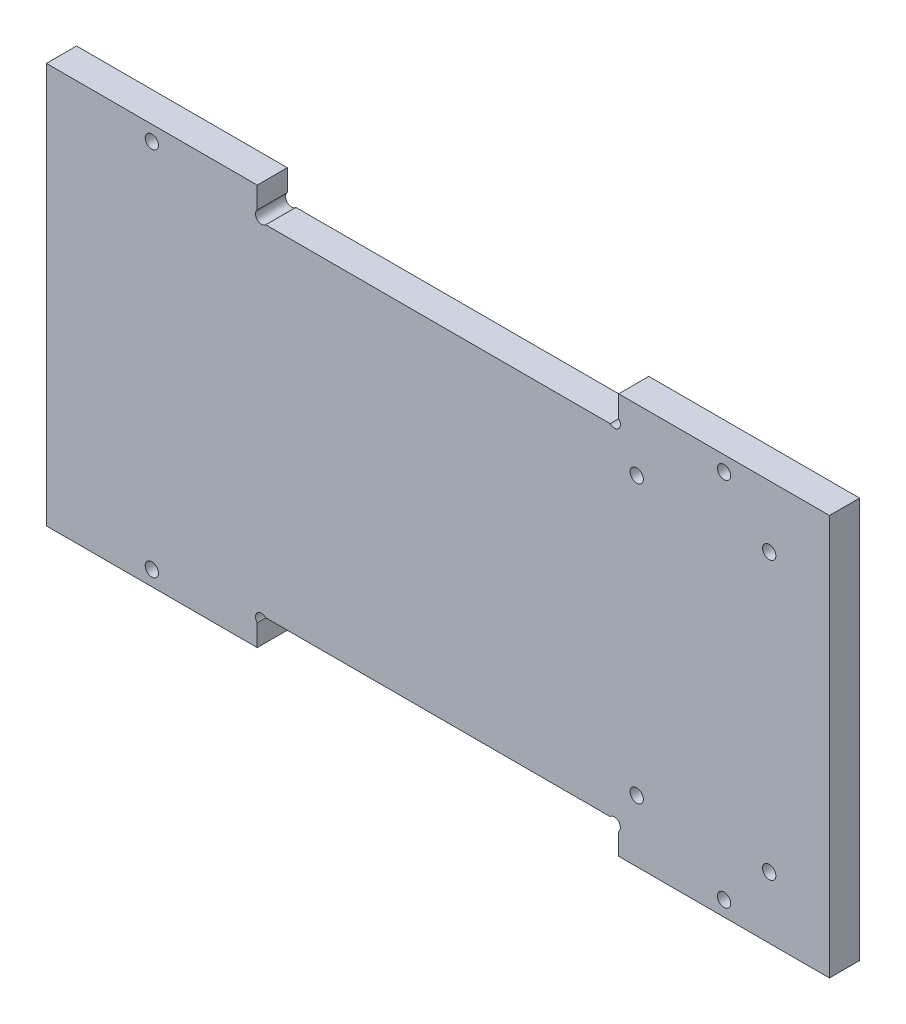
SolidWorks part; units mm, degrees
ref_plane "Plan de face" through (0, 0, 0) normal (0, 0, 1) x (1, 0, 0)
ref_plane "Plan de dessus" through (0, 0, 0) normal (0, 1, 0) x (1, 0, 0)
ref_plane "Plan de droite" through (0, 0, 0) normal (1, 0, 0) x (0, 0, -1)
sketch "Esquisse1" plane through (0, 0, 0) normal (0, 0, 1) x (1, 0, 0)
  line L1 (0, 0) -> (130, 0)
  line L2 (0, 0) -> (0, 66.5)
  line L3 (0, 66.5) -> (130, 66.5)
  line L4 (130, 0) -> (130, 66.5)
  dimension "D1" = 66.5
  dimension "D2" = 130
extrude "Boss.-Extru.1" add sketch "Esquisse1" along normal blind 5
sketch "Esquisse2" plane through (0, 0, 5) normal (0, 0, 1) x (1, 0, 0)
  line L0 (130, 66.5) -> (0, 66.5) construction
  line L1 (0, 66.5) -> (0, 0) construction
  line L3 (5.5, 51.25) -> (81, 51.25) construction
  line L4 (3.5, 15.25) -> (83, 15.25) construction
  circle A0 centre (81, 51.25) radius 1.1
  circle A1 centre (3.5, 15.25) radius 1.1
  circle A2 centre (83, 15.25) radius 1.1
  point P10 (5.5, 51.25)
  dimension "D1" = 2.2
  dimension "D4" = 36
  dimension "D5" = 79.5
  dimension "D6" = 2.2
  dimension "D7" = 2.2
  dimension "D2" = 15.25
  dimension "D3" = 75.5
  dimension "D8" = 81
  dimension "D9" = 3.5
extrude "Enlèv. mat.-Extru.1" [suppressed] cut sketch "Esquisse2" against normal up to next
sketch "Esquisse3" plane through (0, 0, 5) normal (0, 0, 1) x (1, 0, 0)
  line L0 (130, 66.5) -> (0, 66.5) construction
  line L2 (130, 0) -> (130, 66.5) construction
  circle A0 centre (120, 56.25) radius 1.1
  circle A1 centre (120, 10.25) radius 1.1
  circle A2 centre (98, 10.25) radius 1.1
  circle A3 centre (98, 56.25) radius 1.1
  dimension "D1" = 2.2
  dimension "D2" = 2.2
  dimension "D3" = 2.2
  dimension "D4" = 2.2
  dimension "D5" = 22
  dimension "D6" = 46
  dimension "D7" = 10.25
  dimension "D8" = 10
extrude "Enlèv. mat.-Extru.2" cut sketch "Esquisse3" against normal up to next
sketch "Esquisse4" [suppressed] plane through (0, 0, 0) normal (0, 0, -1) x (-1, 0, 0)
  circle A0 centre (-3.5, 15.25) radius 2
  circle A1 centre (-81, 51.25) radius 2
  circle A2 centre (-83, 15.25) radius 2
  dimension "D1" = 4
  dimension "D2" = 4
  dimension "D3" = 4
extrude "Enlèv. mat.-Extru.3" [suppressed] cut sketch "Esquisse4" against normal blind 1.5
sketch "Esquisse6" plane through (0, 0, 0) normal (0, 0, -1) x (-1, 0, 0)
  line L0 (-65, 0) -> (-65, 66.5) construction
  line L1 (0, 0) -> (-130, 0) construction
  line L2 (-130, 66.5) -> (0, 66.5) construction
  line L4 (-35, 0) -> (-95, 0)
  line L5 (-35, 0) -> (-35, 5)
  line L6 (-35, 5) -> (-95, 5)
  line L7 (-95, 0) -> (-95, 5)
  point P10 (-65, 0)
  dimension "D1" = 5
  dimension "D2" = 60
extrude "Enlèv. mat.-Extru.4" cut sketch "Esquisse6" against normal up to next
sketch "Esquisse7" plane through (0, 0, 0) normal (0, 0, -1) x (-1, 0, 0)
  line L0 (-95, 5) -> (-79.5907, -10.4093) construction
  line L1 (-35, 5) -> (-55.2795, -15.2795) construction
  line L2 (-35, 5) -> (-95, 5) construction
  circle A0 centre (-94.2929, 4.2929) radius 1
  circle A1 centre (-35.7071, 4.2929) radius 1
  dimension "D3" = 2
  dimension "D4" = 2
  dimension "D1" = 45
  dimension "D2" = 45
extrude "Enlèv. mat.-Extru.5" cut sketch "Esquisse7" against normal up to next
ref_plane "Plan1" through (0, 33.25, 0) normal (0, -1, 0) x (1, 0, 0)
mirror "Symétrie1" about plane through (0, 33.25, 0) normal (0, -1, 0) of "Enlèv. mat.-Extru.4", "Enlèv. mat.-Extru.5"
ref_plane "Plan2" through (65, 0, 0) normal (-1, 0, 0) x (0, 0, 1)
sketch "Esquisse8" plane through (0, 0, 0) normal (0, 0, -1) x (-1, 0, 0)
  line L0 (-112.5, 0) -> (-112.5, 23.1606) construction
  line L1 (-95, 0) -> (-130, 0) construction
  circle A0 centre (-112.5, 2.5) radius 1.1
  dimension "D1" = 2.2
  dimension "D2" = 2.5
extrude "Enlèv. mat.-Extru.6" cut sketch "Esquisse8" against normal up to next
mirror "Symétrie2" about plane through (65, 0, 0) normal (-1, 0, 0) of "Enlèv. mat.-Extru.6"
mirror "Symétrie3" about plane through (0, 33.25, 0) normal (0, -1, 0) of "Symétrie2", "Enlèv. mat.-Extru.6"
